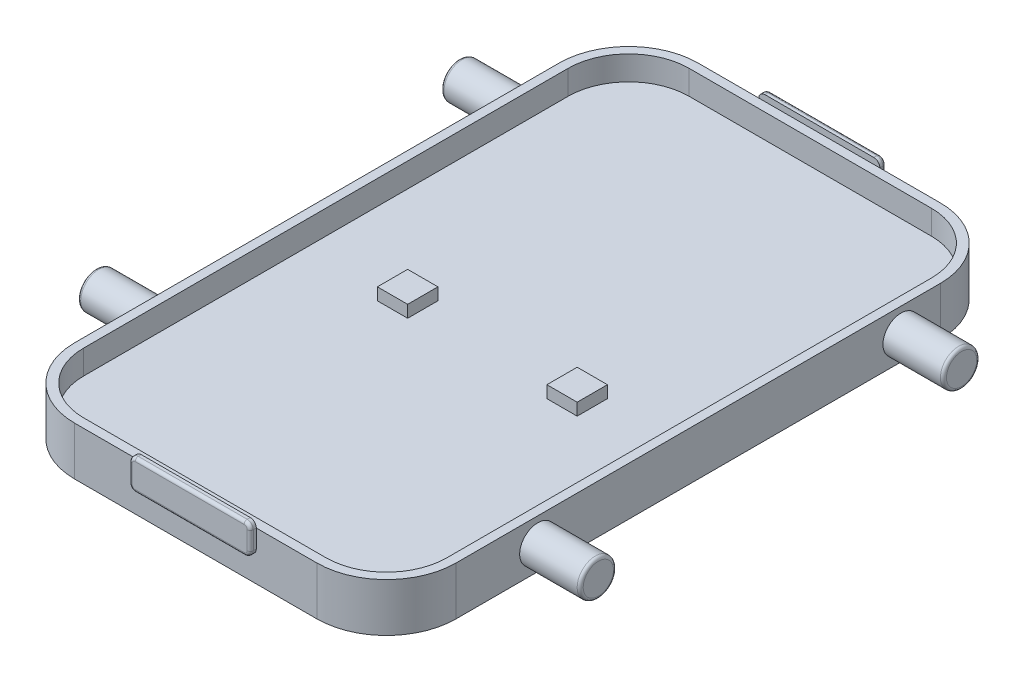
SolidWorks part; units mm, degrees
ref_plane "正面" through (0, 0, 0) normal (0, 0, 1) x (1, 0, 0)
ref_plane "平面" through (0, 0, 0) normal (0, 1, 0) x (1, 0, 0)
ref_plane "右側面" through (0, 0, 0) normal (1, 0, 0) x (0, 0, -1)
sketch "ｽｹｯﾁ1" plane through (0, 0, 0) normal (0, 1, 0) x (1, 0, 0)
  line L0 (31.5, -51.5) -> (-31.5, 51.5) construction
  line L1 (-31.5, 51.5) -> (31.5, 51.5)
  line L2 (-31.5, 51.5) -> (-31.5, -51.5)
  line L3 (-31.5, -51.5) -> (31.5, -51.5)
  line L4 (31.5, 51.5) -> (31.5, -51.5)
  dimension "D1" = 63
  dimension "D2" = 103
extrude "押し出し1" add sketch "ｽｹｯﾁ1" along normal mid plane 8
fillet "ﾌｨﾚｯﾄ1" radius 11.5 4 edges at (-31.5, 0, -51.5) (31.5, 0, -51.5) (-31.5, 0, 51.5) (31.5, 0, 51.5)
sketch "ｽｹｯﾁ2" plane through (0, 0, 0) normal (1, 0, 0) x (0, 0, -1)
  line L0 (-51.5, -4) -> (-51.5, 4) construction
  line L1 (-26.5, 0) -> (33.5, 0) construction
  circle A0 centre (-26.5, 0) radius 3
  circle A1 centre (33.5, 0) radius 3
  dimension "D2" = 60
  dimension "D3" = 6
  dimension "D1" = 25
extrude "押し出し2" add sketch "ｽｹｯﾁ2" along normal mid plane 83
sketch "ｽｹｯﾁ3" plane through (0, 4, 0) normal (0, 1, 0) x (1, 0, 0)
  line L8 (20, 50) -> (-20, 50)
  line L9 (-30, 40) -> (-30, -40)
  line L10 (-20, -50) -> (20, -50)
  line L11 (30, -40) -> (30, 40)
  line L12 (20, 50) -> (-20, 50)
  line L13 (-30, 40) -> (-30, -40)
  line L14 (-20, -50) -> (20, -50)
  line L15 (30, -40) -> (30, 40)
  arc A8 (-20, 50) -> (-30, 40) centre (-20, 40) ccw
  arc A9 (-30, -40) -> (-20, -50) centre (-20, -40) ccw
  arc A10 (20, -50) -> (30, -40) centre (20, -40) ccw
  arc A11 (30, 40) -> (20, 50) centre (20, 40) ccw
  arc A12 (-20, 50) -> (-30, 40) centre (-20, 40) ccw
  arc A13 (-30, -40) -> (-20, -50) centre (-20, -40) ccw
  arc A14 (20, -50) -> (30, -40) centre (20, -40) ccw
  arc A15 (30, 40) -> (20, 50) centre (20, 40) ccw
  dimension "D1" = 1.5
extrude "ｶｯﾄ - 押し出し1" cut sketch "ｽｹｯﾁ3" against normal blind 4
sketch "ｽｹｯﾁ4" plane through (0, 0, 51.5) normal (0, 0, 1) x (1, 0, 0)
  line L0 (0, 0) -> (0, 8.6768) construction
  line L2 (-10, 5) -> (10, 5)
  line L3 (-10, 5) -> (-10, 0)
  line L4 (-10, 0) -> (10, 0)
  line L5 (10, 5) -> (10, 0)
  dimension "D1" = 20
  dimension "D2" = 5
extrude "押し出し3" add sketch "ｽｹｯﾁ4" along normal blind 1
fillet "ﾌｨﾚｯﾄ2" radius 1 4 edges at (10, 0, 52) (10, 5, 52) (-10, 5, 52) (-10, 0, 52)
mirror "ﾐﾗｰ1" about plane through (0, 0, 0) normal (0, 0, 1) of "ﾌｨﾚｯﾄ2", "押し出し3"
sketch "ｽｹｯﾁ5" plane through (0, 0, -51.5) normal (0, 0, -1) x (-1, 0, 0)
  line L0 (-20, -4) -> (20, -4) construction
  circle A0 centre (17.5, -4) radius 2.5
  dimension "D1" = 5
  dimension "D2" = 17.5
extrude "押し出し4" add sketch "ｽｹｯﾁ5" along normal blind 3 and the other way blind 10
sketch "ｽｹｯﾁ6" plane through (0, 0, -41.5) normal (0, 0, 1) x (1, 0, 0)
  line L0 (-20.8354, -4) -> (-14.3043, -4) construction
  line L1 (-15, -4) -> (-20, -4)
  line L2 (-15, -4) -> (-20, -4)
  arc A1 (-20, -4) -> (-15, -4) centre (-17.5, -4) ccw
  arc A2 (-20, -4) -> (-15, -4) centre (-17.5, -4) ccw
  dimension "D1" = 0
revolve "回転1" add sketch "ｽｹｯﾁ6" angle 360 about L0
sketch "ｽｹｯﾁ7" plane through (0, 0, 0) normal (0, 1, 0) x (1, 0, 0)
  line L0 (0, 50) -> (0, -50) construction
  line L1 (20, 50) -> (-20, 50) construction
  line L2 (-20, -50) -> (20, -50) construction
  line L3 (0, -2.5) -> (-14, -2.5) construction
  line L4 (-16.5, -5) -> (-11.5, 0) construction
  line L5 (-16.5, 0) -> (-11.5, 0)
  line L6 (-16.5, 0) -> (-16.5, -5)
  line L7 (-16.5, -5) -> (-11.5, -5)
  line L8 (-11.5, 0) -> (-11.5, -5)
  line L10 (11.5, 0) -> (11.5, -5)
  line L11 (16.5, 0) -> (11.5, 0)
  line L12 (16.5, -5) -> (11.5, -5)
  line L13 (16.5, 0) -> (16.5, -5)
  line L14 (10, -51.5) -> (20, -51.5) construction
  dimension "D1" = 5
  dimension "D2" = 49
  dimension "D3" = 28
extrude "押し出し5" add sketch "ｽｹｯﾁ7" along normal blind 2
fillet "ﾌｨﾚｯﾄ3" radius 0.5 21 edges at (0, 0, -52.5) (10, 2.5, -52.5) (-10, 2.5, -52.5) (0, 5, -52.5) (-9.7071, 0.2929, -52.5) (-9.7071, 4.7071, -52.5) (9.7071, 4.7071, -52.5) (9.7071, 0.2929, -52.5) (-20, -4, -54.5) (-41.5, 0, 23.5) (41.5, 0, 23.5) (-41.5, 0, -36.5) (41.5, 0, -36.5) (10, 2.5, 52.5) (0, 0, 52.5) (-10, 2.5, 52.5) (0, 5, 52.5) (-9.7071, 0.2929, 52.5) (-9.7071, 4.7071, 52.5) (9.7071, 4.7071, 52.5) (9.7071, 0.2929, 52.5)
